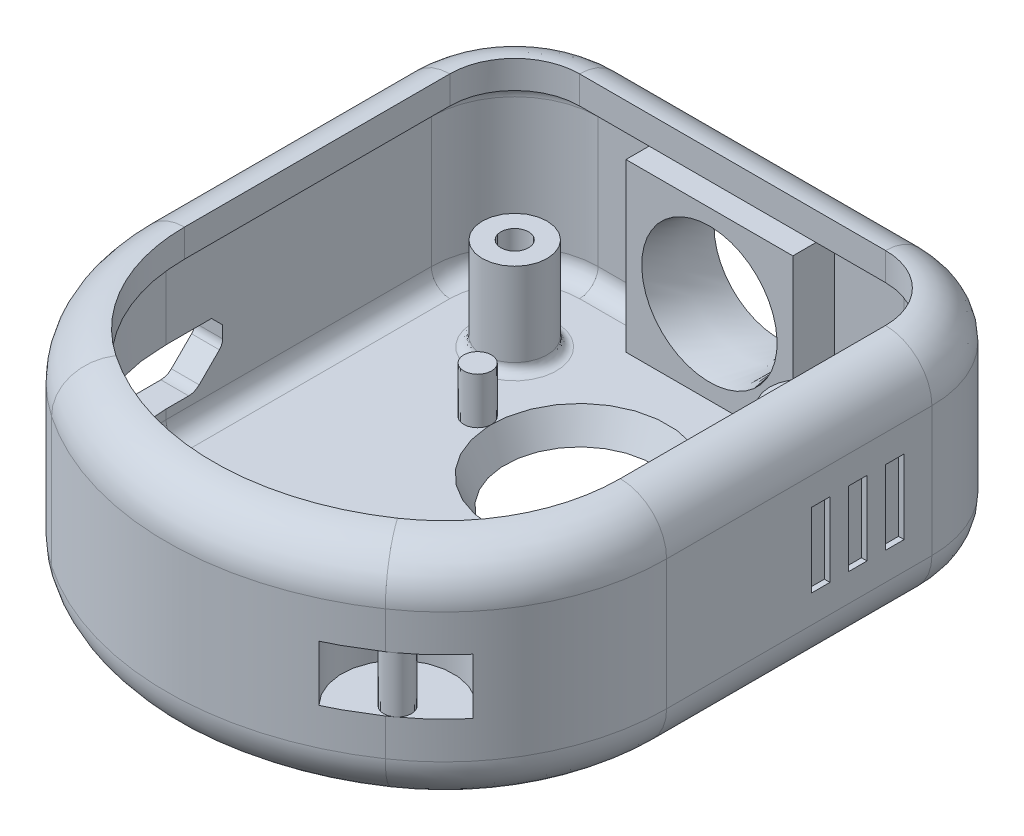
SolidWorks part; units mm, degrees
ref_plane "前视基准面" through (0, 0, 0) normal (0, 0, 1) x (1, 0, 0)
ref_plane "上视基准面" through (0, 0, 0) normal (0, 1, 0) x (1, 0, 0)
ref_plane "右视基准面" through (0, 0, 0) normal (1, 0, 0) x (0, 0, -1)
sketch "草图1" plane through (0, 0, 0) normal (0, 1, 0) x (1, 0, 0)
  line L0 (-14.25, 16.5) -> (-14.25, -7.7758)
  line L1 (-14.25, 16.5) -> (14.25, 16.5)
  line L2 (-14.25, 16.5) -> (-14.25, -16.5) construction
  line L3 (-14.25, -16.5) -> (14.25, -16.5) construction
  line L4 (14.25, 16.5) -> (14.25, -16.5) construction
  line L5 (-14.25, 16.5) -> (14.25, -16.5) construction
  line L6 (-14.25, -16.5) -> (14.25, 16.5) construction
  line L7 (14.25, 16.5) -> (14.25, -7.7758)
  arc A0 (-14.25, -7.7758) -> (14.25, -7.7758) centre (0, -0.5) ccw
  point P0 (0, 0)
  dimension "D3" = 16
  dimension "D1" = 28.5
  dimension "D2" = 33
extrude "凸台-拉伸1" add sketch "草图1" along normal blind 12
fillet "圆角1" radius 6 2 edges at (14.25, 6, -16.5) (-14.25, 6, -16.5)
fillet "圆角2" radius 12 2 edges at (14.25, 6, 7.7758) (-14.25, 6, 7.7758)
fillet "圆角5" radius 2.5 16 edges at (-12.4926, 0, -14.7426) (0, 0, -16.5) (12.4926, 0, -14.7426) (14.25, 0, -3.3464) (12.8566, 0, 9.4197) (0, 0, 16.5) (-12.8566, 0, 9.4197) (-12.4926, 12, -14.7426) (0, 12, -16.5) (12.4926, 12, -14.7426) (14.25, 12, -3.3464) (12.8566, 12, 9.4197) (0, 12, 16.5) (-12.8566, 12, 9.4197) (-14.25, 0, -3.3464) (-14.25, 12, -3.3464)
shell "抽壳1" thickness 1.5
sketch "草图2" plane through (0, 0, 0) normal (0, -1, 0) x (1, 0, 0)
  line L0 (8.25, -16.5) -> (-8.25, -16.5) construction
  circle A0 centre (0, -5.75) radius 4
  dimension "D2" = 8
  dimension "D1" = 10.75
sketch "草图3" plane through (0, 1.5, 0) normal (0, 1, 0) x (1, 0, 0)
  circle A0 centre (0, 5.75) radius 4.75
  dimension "D1" = 9.5
loft "切除-放样1" cut profiles "草图3", "草图2"
sketch "草图4" plane through (0, 0, -15) normal (0, 0, 1) x (1, 0, 0)
  line L0 (7.5937, 1.5) -> (-7.5938, 1.5) construction
  line L1 (-4.5, 10.5) -> (4.5, 10.5)
  line L2 (-4.5, 10.5) -> (-4.5, 1.5)
  line L3 (-4.5, 1.5) -> (4.5, 1.5)
  line L4 (4.5, 10.5) -> (4.5, 1.5)
  line L5 (-4.5, 10.5) -> (4.5, 1.5) construction
  line L6 (-4.5, 1.5) -> (4.5, 10.5) construction
  line L7 (-7.5938, 10.5) -> (7.5937, 10.5) construction
  point P0 (0, 6)
  dimension "D1" = 9
extrude "凸台-拉伸2" add sketch "草图4" along normal blind 2.25
sketch "草图5" plane through (0, 0, -16.5) normal (0, 0, -1) x (-1, 0, 0)
  line L0 (-8.25, 2.5) -> (8.25, 2.5) construction
  circle A0 centre (0, 6) radius 3.5
  dimension "D1" = 7
sketch "草图6" plane through (0, 0, -12.75) normal (0, 0, 1) x (1, 0, 0)
  circle A0 centre (0, 6) radius 3.65
  dimension "D1" = 7.3
loft "切除-放样2" cut profiles "草图6", "草图5"
sketch "草图7" plane through (-14.25, 0, 0) normal (-1, 0, 0) x (0, 0, 1)
  line L0 (16.5, 2.5) -> (16.5, 9.5) construction
  line L1 (0.75, 6) -> (9.25, 6) construction
  line L2 (0.75, 6) -> (0.75, 3) construction
  line L3 (0.75, 3) -> (9.25, 3) construction
  line L4 (9.25, 6) -> (9.25, 3) construction
  line L5 (0.75, 6) -> (9.25, 3) construction
  line L6 (0.75, 3) -> (9.25, 6) construction
  line L7 (3.8072, 1.5) -> (-10.5, 1.5) construction
  line L8 (2.5814, 3) -> (7.4186, 3)
  line L9 (1.35, 6) -> (8.65, 6)
  line L10 (0.75, 5.4) -> (0.75, 4.7485)
  line L11 (9.25, 5.4) -> (9.25, 4.7485)
  line L12 (9.0743, 4.3243) -> (7.9843, 3.2343)
  line L13 (0.9257, 4.3243) -> (2.0157, 3.2343)
  line L14 (0.75, 5.4) -> (1.35, 6)
  line L15 (8.65, 6) -> (9.25, 5.4)
  arc A0 (9.25, 4.7485) -> (9.0743, 4.3243) centre (8.65, 4.7485) cw
  arc A1 (0.75, 4.7485) -> (0.9257, 4.3243) centre (1.35, 4.7485) ccw
  arc A4 (7.4186, 3) -> (7.9843, 3.2343) centre (7.4186, 3.8) ccw
  arc A5 (2.5814, 3) -> (2.0157, 3.2343) centre (2.5814, 3.8) cw
  point P0 (5, 4.5)
  point P11 (5, 3)
  point P16 (9.25, 4.5)
  point P19 (0.75, 4.5)
  point P28 (7.75, 3)
  point P31 (2.25, 3)
  dimension "D6" = 0.6
  dimension "D7" = 0.8
  dimension "D1" = 8.5
  dimension "D2" = 3
  dimension "D3" = 11.5
  dimension "D4" = 1.5
  dimension "D5" = 5.5
  dimension "D8" = 0.8485
extrude "切除-拉伸1" cut sketch "草图7" against normal up to next
ref_plane "基准面1" through (0, 6, 0) normal (0, 1, 0) x (1, 0, 0)
sketch "草图8" plane through (0, 6, 0) normal (0, 1, 0) x (1, 0, 0)
  arc A0 (11.8139, -11.0551) -> (6.1576, -15.1531) centre (8.8505, -12.9174) ccw
  arc A1 (9, -13.7288) -> (14.25, -3.8072) centre (2.25, -3.8072) ccw construction
  arc A2 (6.1576, -15.1531) -> (11.8139, -11.0551) centre (2.25, -3.8072) ccw
  circle A3 centre (8.8505, -12.9174) radius 0.75 construction
  arc A4 (8.1562, -12.4886) -> (12.75, -3.8072) centre (2.25, -3.8072) ccw construction
  dimension "D1" = 7
  dimension "D2" = 1.5
extrude "凸台-拉伸3" add sketch "草图8" along normal mid plane 5
sketch "草图9" plane through (0, 6, 0) normal (0, 1, 0) x (1, 0, 0)
  arc A1 (8.1562, -12.4886) -> (12.75, -3.8072) centre (2.25, -3.8072) ccw construction
  circle A2 centre (8.8505, -12.9174) radius 0.75
  circle A4 centre (8.8505, -12.9174) radius 3
  dimension "D1" = 6
extrude "切除-拉伸2" cut sketch "草图9" against normal mid plane 3
sketch "草图10" plane through (0, 1.5, 0) normal (0, 1, 0) x (1, 0, 0)
  line L0 (0, -983.5) -> (0, 49016.5) construction
  line L1 (-8.25, 14) -> (-4.5, 14) construction
  circle A0 centre (-7.75, 10) radius 1.75
  circle A1 centre (7.75, 10) radius 1.75
  circle A2 centre (-7.75, 10) radius 0.75
  circle A3 centre (7.75, 10) radius 0.75
  point P7 (0, 0)
  dimension "D1" = 3.5
  dimension "D2" = 1.5
  dimension "D3" = 15.5
  dimension "D4" = 4
extrude "凸台-拉伸4" add sketch "草图10" along normal blind 5
fillet "圆角6" radius 0.5 2 edges at (7.75, 1.5, -8.25) (-7.75, 1.5, -8.25)
sketch "草图11" plane through (0, 0, 0) normal (0, -1, 0) x (-1, 0, 0)
  line L0 (0, -1000) -> (0, 49000) construction
  line L5 (0, -1) -> (-0.3153, -4)
  line L6 (-0.3153, -4) -> (-0.3153, -9)
  line L7 (-0.3153, -9) -> (0, -12)
  line L8 (0, -12) -> (0.3153, -9)
  line L9 (0.3153, -9) -> (0.3153, -4)
  line L10 (0.3153, -4) -> (0, -1)
  point P12 (0, 0)
  dimension "D1" = 3
  dimension "D2" = 3
  dimension "D3" = 11
  dimension "D4" = 6
  dimension "D5" = 1
extrude "切除-拉伸3" cut sketch "草图11" against normal blind 0.5
sketch "草图12" plane through (0, 1.5, 0) normal (0, 1, 0) x (1, 0, 0)
  line L1 (-1, -12.5) -> (1, -12.5)
  line L2 (-1, -12.5) -> (-1, -15.5)
  line L3 (-1, -15.5) -> (1, -15.5)
  line L4 (1, -12.5) -> (1, -15.5)
  line L5 (-1, -12.5) -> (1, -15.5) construction
  line L6 (-1, -15.5) -> (1, -12.5) construction
  arc A0 (-7.5938, -11.6618) -> (7.5937, -11.6618) centre (0, -0.5) ccw construction
  point P0 (0, -14)
  dimension "D1" = 2
  dimension "D2" = 3
sketch "草图13" plane through (14.25, 0, 0) normal (1, 0, 0) x (0, 0, -1)
  line L0 (10.5, 2.5) -> (10.5, 9.5) construction
  line L1 (8, 8) -> (9, 8)
  line L2 (8, 8) -> (8, 4)
  line L3 (8, 4) -> (9, 4)
  line L4 (9, 8) -> (9, 4)
  line L5 (8, 8) -> (9, 4) construction
  line L6 (8, 4) -> (9, 8) construction
  line L7 (6, 8) -> (7, 8)
  line L8 (6, 8) -> (6, 4)
  line L9 (6, 4) -> (7, 4)
  line L10 (7, 8) -> (7, 4)
  line L11 (6, 8) -> (7, 4) construction
  line L12 (6, 4) -> (7, 8) construction
  line L13 (4, 8) -> (5, 8)
  line L14 (4, 8) -> (4, 4)
  line L15 (4, 4) -> (5, 4)
  line L16 (5, 8) -> (5, 4)
  line L17 (4, 8) -> (5, 4) construction
  line L18 (4, 4) -> (5, 8) construction
  line L19 (16.5, 9.5) -> (16.5, 2.5) construction
  point P0 (8.5, 6)
  point P5 (6.5, 6)
  point P10 (4.5, 6)
  point P19 (10.5, 6)
  dimension "D1" = 2
  dimension "D2" = 2
  dimension "D3" = 4
  dimension "D4" = 1
  dimension "D5" = 8
extrude "切除-拉伸4" cut sketch "草图13" against normal blind 0.3
mirror "镜向1" about plane through (0, 0, 0) normal (1, 0, 0) of "切除-拉伸4"
sketch "草图17" plane through (0, 0, -16.5) normal (0, 0, -1) x (-1, 0, 0)
  line L7 (-14.25, 6) -> (14.25, 6) construction
  line L8 (-14.25, 2.5) -> (-14.25, 9.5) construction
  circle A2 centre (0, 6) radius 6 construction
  circle A3 centre (0, 6) radius 9.5 construction
  arc A6 (-5.9161, 7) -> (-5.9161, 5) centre (0, 6) ccw construction
  arc A8 (-6.4091, 7.0833) -> (-6.4091, 4.9167) centre (0, 6) ccw
  arc A12 (-5.4231, 6.9167) -> (-5.4231, 5.0833) centre (0, 6) ccw
  arc A13 (-6.4091, 7.0833) -> (-5.4231, 6.9167) centre (-5.9161, 7) cw
  arc A14 (-6.4091, 4.9167) -> (-5.4231, 5.0833) centre (-5.9161, 5) ccw
  arc A15 (-9.2871, 8) -> (-9.2871, 4) centre (0, 6) ccw construction
  arc A16 (-9.7759, 8.1053) -> (-9.7759, 3.8947) centre (0, 6) ccw
  arc A17 (-8.7983, 7.8947) -> (-8.7983, 4.1053) centre (0, 6) ccw
  arc A18 (-9.7759, 8.1053) -> (-8.7983, 7.8947) centre (-9.2871, 8) cw
  arc A19 (-9.7759, 3.8947) -> (-8.7983, 4.1053) centre (-9.2871, 4) ccw
  dimension "D1" = 1
  dimension "D2" = 1
  dimension "D3" = 0.5
  dimension "D5" = 12
  dimension "D10" = 19
  dimension "D6" = 2
  dimension "D7" = 2
  dimension "D4" = 0.5
  dimension "D8" = 0.5
  dimension "D9" = 0.5
extrude "切除-拉伸5" cut sketch "草图17" against normal blind 0.5
mirror "镜向2" about plane through (0, 0, 0) normal (1, 0, 0) of "切除-拉伸5"
sketch "草图18" plane through (0, 3.5, 0) normal (0, -1, 0) x (1, 0, 0)
  line L0 (-1, 12.5) -> (-1, 15.5) construction
  line L1 (-1, 15.5) -> (1, 15.5) construction
  line L2 (1, 12.5) -> (1, 15.5) construction
  line L3 (-1, 12.5) -> (1, 12.5) construction
  line L4 (-1, 12.5) -> (-1, 15.5)
  line L5 (-1, 15.5) -> (1, 15.5)
  line L6 (1, 12.5) -> (1, 15.5)
  line L7 (-1, 12.5) -> (1, 12.5)
extrude "凸台-拉伸5" add sketch "草图18" against normal up to vertex
sketch "草图19" plane through (0, 1.5, 0) normal (0, 1, 0) x (1, 0, 0)
  line L0 (-1004.3422, 5.75) -> (48995.6578, 5.75) construction
  circle A1 centre (-5.5, 5.75) radius 0.75
  circle A2 centre (5.5, 5.75) radius 0.75
  circle A3 centre (0, 5.75) radius 4.75 construction
  point P8 (0, 5.75)
  dimension "D1" = 1.5
extrude "凸台-拉伸6" add sketch "草图19" along normal blind 2.5
